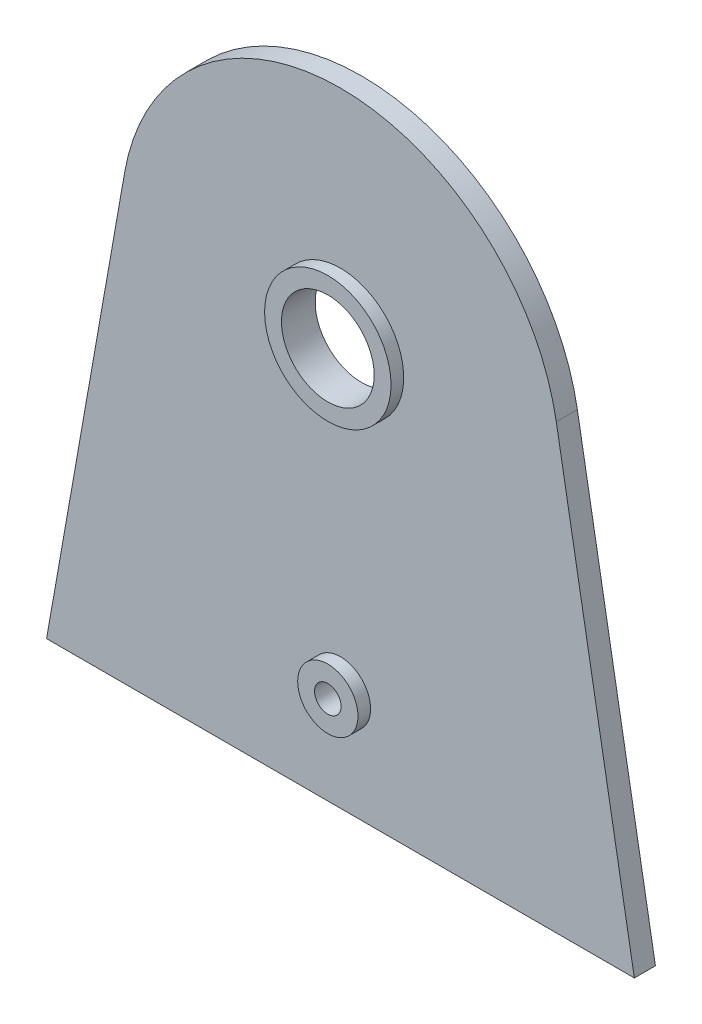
SolidWorks part; units mm, degrees
ref_plane "Front Plane" through (0, 0, 0) normal (0, 0, 1) x (1, 0, 0)
ref_plane "Top Plane" through (0, 0, 0) normal (0, 1, 0) x (1, 0, 0)
ref_plane "Right Plane" through (0, 0, 0) normal (1, 0, 0) x (0, 0, -1)
sketch "Sketch1" plane through (0, 0, 0) normal (0, 0, 1) x (1, 0, 0)
  line L0 (0, 0) -> (0, 72) construction
  line L1 (-69.7296, -24) -> (69.7296, -24)
  line L2 (69.7296, -24) -> (51.21, 81.0297)
  line L3 (-51.21, 81.0297) -> (-69.7296, -24)
  line L4 (0, -24) -> (0, 0) construction
  circle A0 centre (0, 0) radius 3.15
  circle A1 centre (0, 72) radius 11
  arc A2 (-51.21, 81.0297) -> (51.21, 81.0297) centre (0, 72) cw
  point P10 (-86.9687, -28.589)
  dimension "D2" = 6.3
  dimension "D3" = 22
  dimension "D5" = 52
  dimension "D1" = 72
  dimension "D4" = 24
  dimension "D6" = 20
extrude "Boss-Extrude1" add sketch "Sketch1" against normal blind 5
sketch "Sketch2" plane through (0, 0, 0) normal (0, 0, 1) x (1, 0, 0)
  line L0 (-11, 72) -> (-15, 72) construction
  line L1 (-3.15, 0) -> (-7.15, 0) construction
  circle A0 centre (0, 72) radius 15
  circle A1 centre (0, 72) radius 11
  circle A2 centre (0, 72) radius 11 construction
  circle A3 centre (0, 0) radius 7.15
  circle A4 centre (0, 0) radius 3.15
  circle A5 centre (0, 0) radius 3.15 construction
  dimension "D1" = 4
extrude "Boss-Extrude2" add sketch "Sketch2" along normal blind 3
